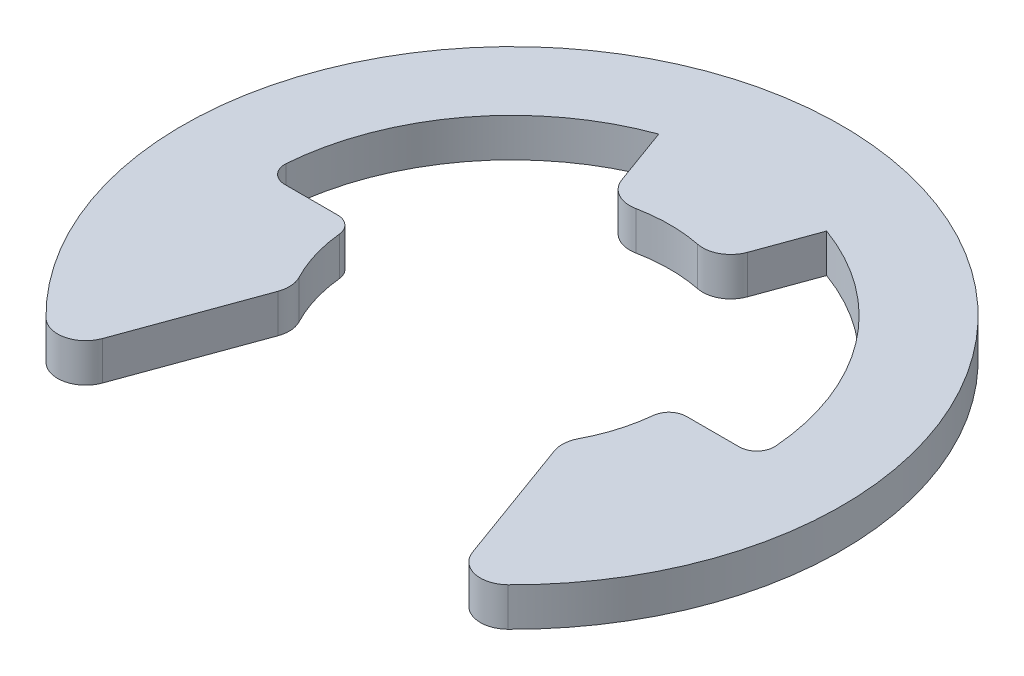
SolidWorks part; units mm, degrees
ref_plane "Front Plane" through (0, 0, 0) normal (0, 0, 1) x (1, 0, 0)
ref_plane "Top Plane" through (0, 0, 0) normal (0, 1, 0) x (1, 0, 0)
ref_plane "Right Plane" through (0, 0, 0) normal (1, 0, 0) x (0, 0, -1)
sketch "Sketch2" plane through (0, 0, 0) normal (0, 1, 0) x (1, 0, 0)
  line L0 (-5.6741, -7.4943) -> (-3.815, -2.3866)
  line L2 (3.815, -2.3866) -> (5.6741, -7.4943)
  line L4 (-4.5, 0) -> (-7, 0)
  line L5 (4.5, 0) -> (7, 0)
  line L6 (-2.3941, 6.5778) -> (-1.5391, 4.2286)
  line L8 (1.5391, 4.2286) -> (2.3941, 6.5778)
  arc A0 (5.6741, -7.4943) -> (-5.6741, -7.4943) centre (0, 0) ccw
  arc A1 (3.815, -2.3866) -> (4.5, 0) centre (0, 0) ccw
  arc A2 (7, 0) -> (2.3941, 6.5778) centre (0, 0) ccw
  arc A3 (-4.5, 0) -> (-3.815, -2.3866) centre (0, 0) ccw
  arc A4 (1.5391, 4.2286) -> (-1.5391, 4.2286) centre (0, 0) ccw
  arc A5 (-2.3941, 6.5778) -> (-7, 0) centre (0, 0) ccw
  point P15 (0, 0)
  point P16 (0, 4.5)
  dimension "D1" = 18.8
  dimension "D2" = 9
  dimension "D3" = 14
  dimension "D4" = 70
  dimension "D5" = 70
  dimension "D6" = 7.63
  dimension "D7" = 40
extrude "Boss-Extrude1" add sketch "Sketch2" along normal mid plane 1.1
fillet "Fillet1" radius 0.8 6 edges at (3.815, 0, 2.3866) (-3.815, 0, 2.3866) (1.5391, 0, -4.2286) (-1.5391, 0, -4.2286) (5.6741, 0, 7.4943) (-5.6741, 0, 7.4943)
fillet "Fillet2" radius 0.5 4 edges at (7, 0, 0) (4.5, 0, 0) (-7, 0, 0) (-4.5, 0, 0)
